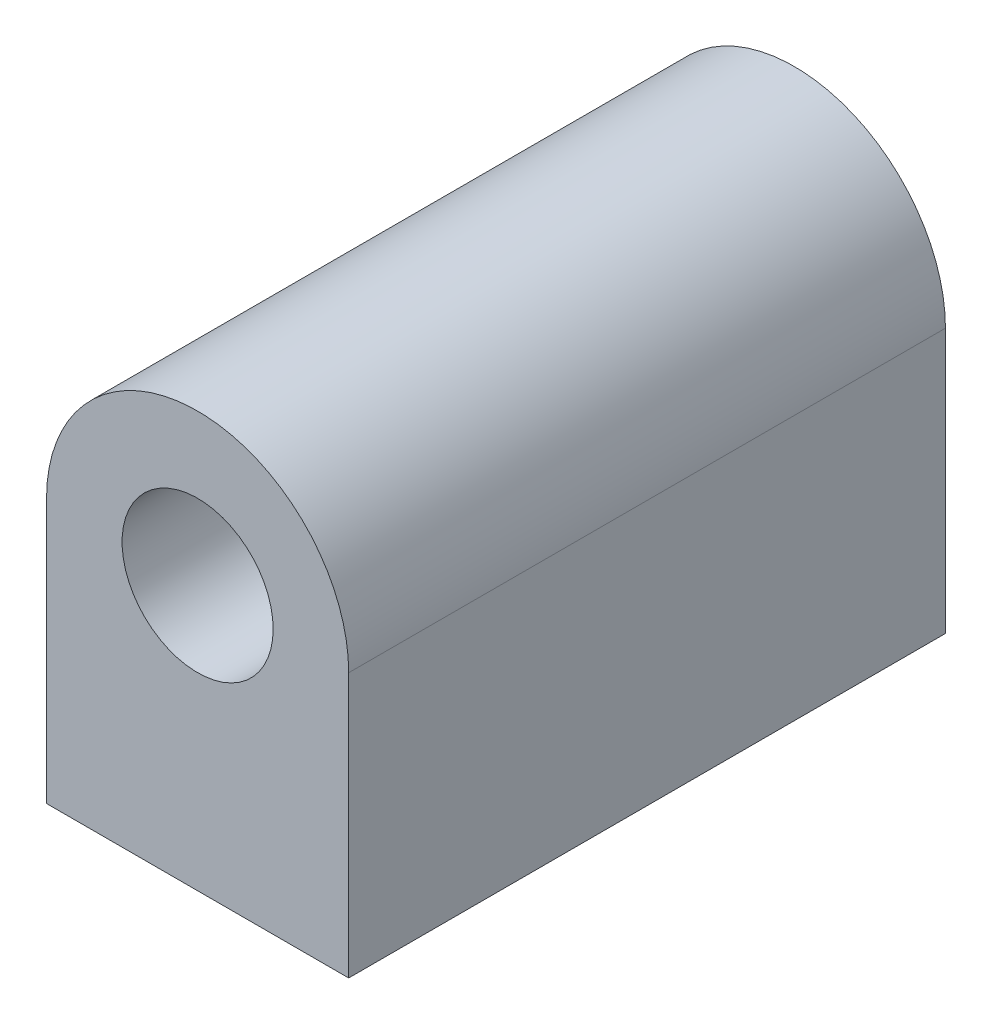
SolidWorks part; units mm, degrees
ref_plane "Plan de face" through (0, 0, 0) normal (0, 0, 1) x (1, 0, 0)
ref_plane "Plan de dessus" through (0, 0, 0) normal (0, 1, 0) x (1, 0, 0)
ref_plane "Plan de droite" through (0, 0, 0) normal (1, 0, 0) x (0, 0, -1)
sketch "Esquisse1" plane through (0, 0, 0) normal (0, 0, 1) x (1, 0, 0)
  line L5 (-20, 0) -> (20, 0)
  line L6 (-20, 0) -> (-20, 35)
  line L8 (20, 0) -> (20, 35)
  arc A1 (-20, 35) -> (20, 35) centre (0, 35) cw
  dimension "D2" = 20
  dimension "D3" = 35
extrude "Extrusion1" add sketch "Esquisse1" along normal mid plane 79
sketch "Esquisse2" plane through (0, 0, 39.5) normal (0, 0, 1) x (1, 0, 0)
  circle A0 centre (0, 35) radius 10
  dimension "D1" = 20
extrude "Enlèv. mat.-Extru.1" cut sketch "Esquisse2" against normal through all
